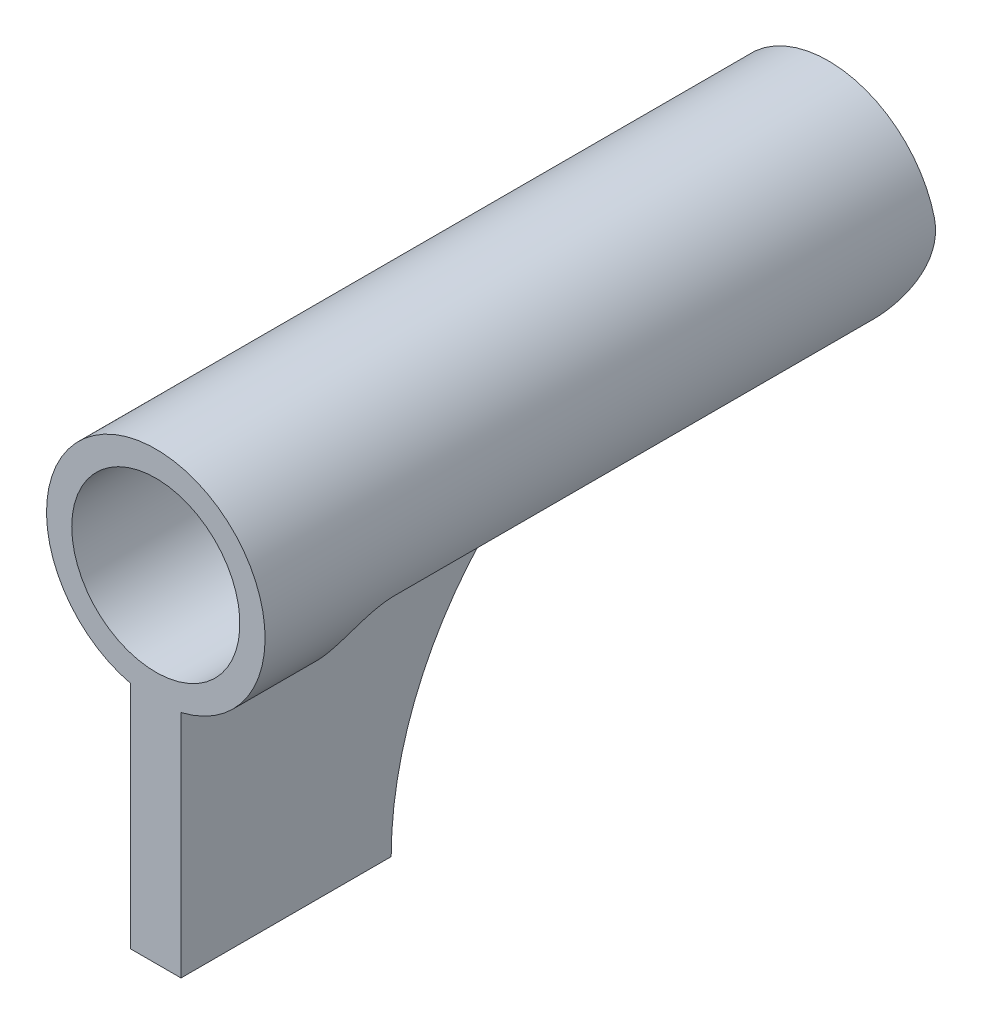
SolidWorks part; units mm, degrees
ref_plane "Plan de face" through (0, 0, 0) normal (0, 0, 1) x (1, 0, 0)
ref_plane "Plan de dessus" through (0, 0, 0) normal (0, 1, 0) x (1, 0, 0)
ref_plane "Plan de droite" through (0, 0, 0) normal (1, 0, 0) x (0, 0, -1)
sketch "Esquisse1" plane through (0, 0, 0) normal (0, 0, 1) x (1, 0, 0)
  circle A0 centre (0, 0) radius 1.3
  dimension "D2" = 2.6
extrude "Boss.-Extru.1" add sketch "Esquisse1" along normal blind 8
sketch "Esquisse2" plane through (0, 0, 0) normal (1, 0, 0) x (0, 0, -1)
  line L0 (-8, 0) -> (-8, -4)
  line L1 (-8, 1.3) -> (-8, -1.3) construction
  line L2 (-8, -4) -> (-5.5, -4)
  line L3 (-8, 0) -> (-1.5, 0)
  line L4 (-1.5, -4) -> (-5.5, -4) construction
  line L5 (0, 0) -> (-1.5, 0) construction
  arc A0 (-1.5, 0) -> (-5.5, -4) centre (-1.5, -4) ccw
  dimension "D1" = 2.5
  dimension "D2" = 4
extrude "Boss.-Extru.2" add sketch "Esquisse2" along normal mid plane 0.6
sketch "Esquisse4" plane through (0, 0, 0) normal (0, 0, -1) x (-1, 0, 0)
  circle A0 centre (0, 0) radius 1
  circle A1 centre (0, 0) radius 1.3 construction
  dimension "D1" = 0.3
extrude "Enlèv. mat.-Extru.1" cut sketch "Esquisse4" against normal through all
sketch "Esquisse5" plane through (0, 0, 0) normal (0, 0, -1) x (-1, 0, 0)
  line L0 (0, 0) -> (-1.8086, -1.8086) construction
  line L1 (0, -4) -> (0, 0) construction
  line L2 (-0.3, -4) -> (0.3, -4) construction
  line L3 (-1.2397, -0.3912) -> (-0.9899, -0.1414)
  line L4 (-0.1414, -0.9899) -> (-0.3912, -1.2397)
  circle A0 centre (0, 0) radius 1 construction
  arc A1 (-0.9899, -0.1414) -> (-0.1414, -0.9899) centre (0, 0) ccw
  circle A2 centre (0, 0) radius 1.3 construction
  arc A3 (-1.2397, -0.3912) -> (-0.3912, -1.2397) centre (0, 0) ccw
  dimension "D1" = 45
  dimension "D2" = 0.6
  dimension "D3" = 0.6
extrude "Enlèv. mat.-Extru.2" cut sketch "Esquisse5" against normal blind 7
fillet "Congé1" radius 0.6 2 edges at (1.1148, -0.2663, 7) (0.2663, -1.1148, 7)
sketch "Esquisse6" plane through (0, 0, 0) normal (1, 0, 0) x (0, 0, -1)
  line L0 (-6.4, -0.3912) -> (0, -0.3912) construction
  line L1 (0, -1.3) -> (0, 1.3) construction
  line L2 (0, -0.3912) -> (-0.7, -0.3912)
  line L3 (0, -0.3912) -> (0, 0.3088)
  arc A0 (-0.7, -0.3912) -> (0, 0.3088) centre (-0.7, 0.3088) ccw
  dimension "D1" = 0.7
extrude "Enlèv. mat.-Extru.3" cut sketch "Esquisse6" along normal blind 1.6
